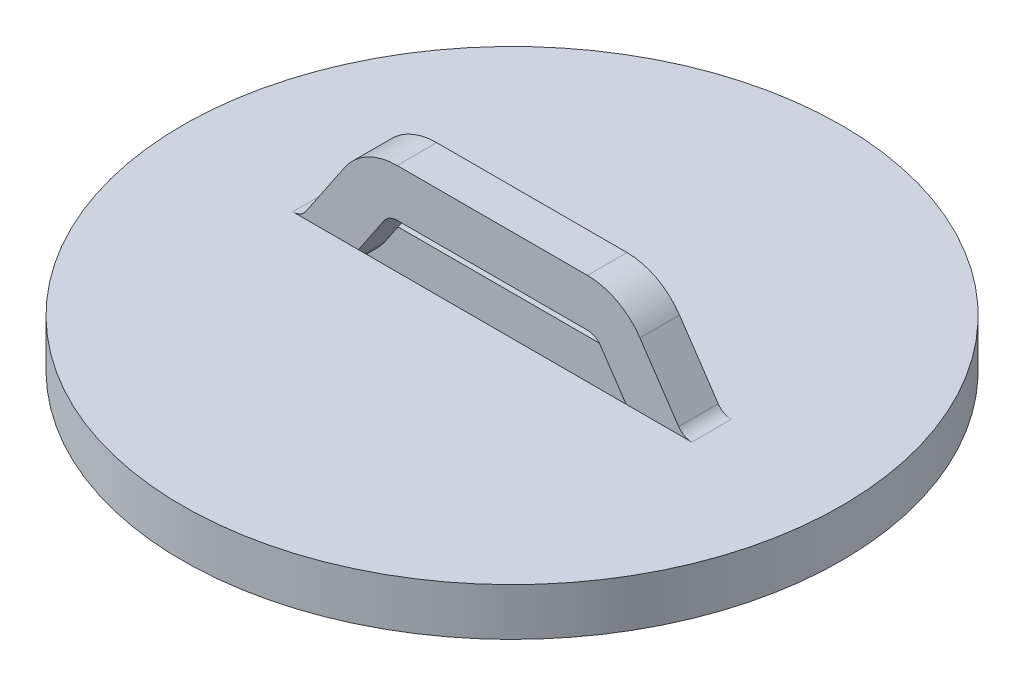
SolidWorks part; units mm, degrees
ref_plane "Front Plane" through (0, 0, 0) normal (0, 0, 1) x (1, 0, 0)
ref_plane "Top Plane" through (0, 0, 0) normal (0, 1, 0) x (1, 0, 0)
ref_plane "Right Plane" through (0, 0, 0) normal (1, 0, 0) x (0, 0, -1)
sketch "Sketch1" plane through (0, 0, 0) normal (0, 0, 1) x (1, 0, 0)
  line L0 (-15.875, 0) -> (-9.6087, 0)
  line L1 (0, 0) -> (0, 12.1848) construction
  line L2 (-8.977, 0.3359) -> (-7.1116, 3.1014)
  line L3 (-4.5847, 4.445) -> (4.5847, 4.445)
  line L4 (7.1116, 3.1014) -> (8.977, 0.3359)
  line L5 (9.6087, 0) -> (15.875, 0)
  line L6 (-15.875, -2.286) -> (-9.6087, -2.286)
  line L7 (-7.0818, -0.9424) -> (-5.2164, 1.8231)
  line L8 (-4.5847, 2.159) -> (4.5847, 2.159)
  line L9 (5.2164, 1.8231) -> (7.0818, -0.9424)
  line L10 (9.6087, -2.286) -> (15.875, -2.286)
  line L11 (-15.875, 0) -> (-15.875, -2.286)
  line L12 (15.875, 0) -> (15.875, -2.286)
  arc A0 (4.5847, 4.445) -> (7.1116, 3.1014) centre (4.5847, 1.397) cw
  arc A1 (-7.1116, 3.1014) -> (-4.5847, 4.445) centre (-4.5847, 1.397) cw
  arc A2 (8.977, 0.3359) -> (9.6087, 0) centre (9.6087, 0.762) ccw
  arc A3 (-8.977, 0.3359) -> (-9.6087, 0) centre (-9.6087, 0.762) cw
  arc A4 (-7.0818, -0.9424) -> (-9.6087, -2.286) centre (-9.6087, 0.762) cw
  arc A5 (-5.2164, 1.8231) -> (-4.5847, 2.159) centre (-4.5847, 1.397) cw
  arc A6 (4.5847, 2.159) -> (5.2164, 1.8231) centre (4.5847, 1.397) cw
  arc A7 (7.0818, -0.9424) -> (9.6087, -2.286) centre (9.6087, 0.762) ccw
  point P15 (9.2035, 0)
  dimension "D4" = 3.048
  dimension "D5" = 0.762
  dimension "D1" = 31.75
  dimension "D2" = 4.445
  dimension "D3" = 56
  dimension "D6" = 9.1694
  dimension "D7" = 2.286
extrude "Boss-Extrude1" add sketch "Sketch1" along normal blind 1.905
sketch "Sketch2" plane through (0, -2.286, 0) normal (0, -1, 0) x (1, 0, 0)
  line L0 (0, 0) -> (0, 1.905) construction
  line L1 (-4.5847, 1.905) -> (4.5847, 1.905) construction
  line L3 (-9.6087, 1.905) -> (9.6087, 1.905)
  line L4 (-9.6087, 1.905) -> (-9.6087, 0)
  line L5 (-9.6087, 0) -> (9.6087, 0)
  line L6 (9.6087, 1.905) -> (9.6087, 0)
  circle A0 centre (0, 0.9525) radius 15.875
extrude "Boss-Extrude2" add sketch "Sketch2" against normal up to vertex
other "DeleteFace1"
